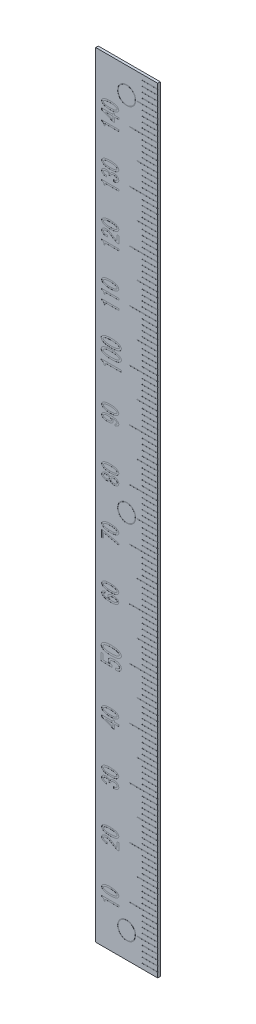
SolidWorks part; units mm, degrees
ref_plane "Front" through (0, 0, 0) normal (0, 0, 1) x (1, 0, 0)
ref_plane "Top" through (0, 0, 0) normal (0, 1, 0) x (1, 0, 0)
ref_plane "Right" through (0, 0, 0) normal (1, 0, 0) x (0, 0, -1)
sketch "Sketch1" plane through (0, 0, 0) normal (0, 0, 1) x (1, 0, 0)
  line L1 (0, 0) -> (0, 150)
  line L2 (0, 0) -> (12, 0)
  line L3 (12, 0) -> (12, 150)
  line L4 (0, 150) -> (12, 150)
  dimension "D1" = 150
  dimension "D2" = 12
extrude "Extrude1" add sketch "Sketch1" along normal blind 0.5
sketch "Sketch2" plane through (0, 0, 0.5) normal (0, 0, 1) x (1, 0, 0)
  line L0 (0, 150) -> (0, 0) construction
  line L1 (0, 0) -> (12, 0) construction
  line L2 (12, 150) -> (0, 150) construction
  circle A0 centre (6, 5) radius 1.75
  circle A1 centre (6, 145) radius 1.75
  circle A2 centre (6, 5) radius 1.65
  circle A3 centre (6, 145) radius 1.65
  circle A4 centre (6, 75) radius 1.75
  circle A5 centre (6, 75) radius 1.65
  dimension "D1" = 6
  dimension "D2" = 6
  dimension "D3" = 5
  dimension "D4" = 5
  dimension "D5" = 3.5
  dimension "D6" = 3.5
  dimension "D7" = 0.1
  dimension "D8" = 2
extrude "Extrude2" cut sketch "Sketch2" against normal blind 0.01
sketch "Sketch3" plane through (0, 0, 0.5) normal (0, 0, 1) x (1, 0, 0)
  line L0 (12, 0) -> (12, 150) construction
  line L1 (1, 137.4) -> (4.5, 137.4) construction
  line L2 (1, 137.4) -> (1, 140.9) construction
  line L3 (1, 140.9) -> (4.5, 140.9) construction
  line L4 (4.5, 137.4) -> (4.5, 140.9) construction
  line L5 (0, 150) -> (0, 0) construction
  line L6 (4.5, 127.4) -> (4.5, 130.9) construction
  line L7 (4.5, 117.4) -> (4.5, 120.9) construction
  line L8 (4.5, 107.4) -> (4.5, 110.9) construction
  line L9 (5, 97.2) -> (5, 102.8) construction
  line L10 (4.5, 88.25) -> (4.5, 91.75) construction
  line L11 (4.5, 78.25) -> (4.5, 81.75) construction
  line L12 (4.5, 68.25) -> (4.5, 71.75) construction
  line L13 (4.5, 58.25) -> (4.5, 61.75) construction
  line L14 (5, 47.375) -> (5, 52.625) construction
  line L15 (4.5, 37.375) -> (4.5, 42.625) construction
  line L16 (5, 110) -> (-4.9003, 110) construction
  line L17 (5, 50) -> (-4.9003, 50) construction
  line L18 (4.5, 27.375) -> (4.5, 32.625) construction
  line L19 (4.5, 17.375) -> (4.5, 22.625) construction
  line L20 (4.5, 7.375) -> (4.5, 12.625) construction
  line L21 (5, 100) -> (-4.9003, 100) construction
  line L22 (5, 120) -> (-4.9003, 120) construction
  line L23 (5, 130) -> (-4.9003, 130) construction
  line L24 (5, 140) -> (-4.9003, 140) construction
  text T0 "140" font "ＭＳ ゴシック" height in points 11
  text T1 "130" font "ＭＳ ゴシック" height in points 11
  text T2 "120" font "ＭＳ ゴシック" height in points 11
  text T3 "110" font "ＭＳ ゴシック" height in points 11
  text T4 "100" font "ＭＳ ゴシック" height in points 13
  text T5 "90" font "ＭＳ ゴシック" height in points 11
  text T6 "80" font "ＭＳ ゴシック" height in points 11
  text T7 "70" font "ＭＳ ゴシック" height in points 11
  text T8 "60" font "ＭＳ ゴシック" height in points 11
  text T9 "50" font "ＭＳ ゴシック" height in points 13
  text T10 "40" font "ＭＳ ゴシック" height in points 11
  text T11 "30" font "ＭＳ ゴシック" height in points 11
  text T12 "20" font "ＭＳ ゴシック" height in points 11
  text T13 "10" font "ＭＳ ゴシック" height in points 11
  point P19 (5, 100)
  dimension "D1" = 3.5
  dimension "D2" = 2.6
  dimension "D3" = 1
  dimension "D4" = 3.5
  dimension "D8" = 5.25
  dimension "D9" = 50
  dimension "D10" = 2
  dimension "D11" = 5.6
  dimension "D12" = 2.6
  dimension "D5" = 3.5
  dimension "D13" = 2.6
  dimension "D14" = 2.6
  dimension "D15" = 7
  dimension "D7" = 7
  dimension "D6" = 5
extrude "Extrude3" cut sketch "Sketch3" against normal blind 0.01
sketch "Sketch4" plane through (0, 0, 0.5) normal (0, 0, 1) x (1, 0, 0)
  line L0 (12, 140.05) -> (6.5, 140.05)
  line L1 (12, 0) -> (12, 150) construction
  line L2 (6.5, 140.05) -> (6.5, 139.95)
  line L3 (6.5, 139.95) -> (12, 139.95)
  line L4 (12, 139.95) -> (12, 140.05)
  line L5 (12, 150) -> (0, 150) construction
  line L6 (12, 148.05) -> (12, 147.95)
  line L7 (12, 144.95) -> (8, 144.95)
  line L8 (12, 144.95) -> (12, 145.05)
  line L9 (12, 145.05) -> (8, 145.05)
  line L10 (8, 144.95) -> (8, 145.05)
  line L11 (12, 149.05) -> (9, 149.05)
  line L12 (12, 149.05) -> (12, 148.95)
  line L13 (12, 148.95) -> (9, 148.95)
  line L14 (9, 149.05) -> (9, 148.95)
  line L15 (12, 148.05) -> (9, 148.05)
  line L16 (12, 147.95) -> (9, 147.95)
  line L17 (9, 148.05) -> (9, 147.95)
  line L18 (12, 147.05) -> (12, 146.95)
  line L19 (12, 147.05) -> (9, 147.05)
  line L20 (12, 146.95) -> (9, 146.95)
  line L21 (9, 147.05) -> (9, 146.95)
  line L22 (12, 146.05) -> (12, 145.95)
  line L23 (12, 146.05) -> (9, 146.05)
  line L24 (12, 145.95) -> (9, 145.95)
  line L25 (9, 146.05) -> (9, 145.95)
  line L26 (12, 130.05) -> (6.5, 130.05)
  line L27 (6.5, 130.05) -> (6.5, 129.95)
  line L28 (6.5, 129.95) -> (12, 129.95)
  line L29 (12, 129.95) -> (12, 130.05)
  line L30 (12, 144.05) -> (12, 143.95)
  line L31 (12, 144.05) -> (9, 144.05)
  line L32 (12, 143.95) -> (9, 143.95)
  line L33 (9, 144.05) -> (9, 143.95)
  line L34 (12, 143.05) -> (12, 142.95)
  line L35 (12, 143.05) -> (9, 143.05)
  line L36 (12, 142.95) -> (9, 142.95)
  line L37 (9, 143.05) -> (9, 142.95)
  line L38 (12, 142.05) -> (12, 141.95)
  line L39 (12, 142.05) -> (9, 142.05)
  line L40 (12, 141.95) -> (9, 141.95)
  line L41 (9, 142.05) -> (9, 141.95)
  line L42 (12, 141.05) -> (12, 140.95)
  line L43 (12, 141.05) -> (9, 141.05)
  line L44 (12, 140.95) -> (9, 140.95)
  line L45 (9, 141.05) -> (9, 140.95)
  line L46 (9, 145.05) -> (9, 144.95)
  line L47 (12, 145.05) -> (9, 145.05)
  line L48 (12, 144.95) -> (9, 144.95)
  line L49 (12, 145.05) -> (12, 144.95)
  line L50 (12, 138.05) -> (12, 137.95)
  line L51 (12, 134.95) -> (8, 134.95)
  line L52 (12, 134.95) -> (12, 135.05)
  line L53 (12, 135.05) -> (8, 135.05)
  line L54 (8, 134.95) -> (8, 135.05)
  line L55 (12, 139.05) -> (9, 139.05)
  line L56 (12, 139.05) -> (12, 138.95)
  line L57 (12, 138.95) -> (9, 138.95)
  line L58 (9, 139.05) -> (9, 138.95)
  line L59 (12, 138.05) -> (9, 138.05)
  line L60 (12, 137.95) -> (9, 137.95)
  line L61 (9, 138.05) -> (9, 137.95)
  line L62 (12, 137.05) -> (12, 136.95)
  line L63 (12, 137.05) -> (9, 137.05)
  line L64 (12, 136.95) -> (9, 136.95)
  line L65 (9, 137.05) -> (9, 136.95)
  line L66 (12, 136.05) -> (12, 135.95)
  line L67 (12, 136.05) -> (9, 136.05)
  line L68 (12, 135.95) -> (9, 135.95)
  line L69 (9, 136.05) -> (9, 135.95)
  line L70 (12, 134.05) -> (12, 133.95)
  line L71 (12, 134.05) -> (9, 134.05)
  line L72 (12, 133.95) -> (9, 133.95)
  line L73 (9, 134.05) -> (9, 133.95)
  line L74 (12, 133.05) -> (12, 132.95)
  line L75 (12, 133.05) -> (9, 133.05)
  line L76 (12, 132.95) -> (9, 132.95)
  line L77 (9, 133.05) -> (9, 132.95)
  line L78 (12, 132.05) -> (12, 131.95)
  line L79 (12, 132.05) -> (9, 132.05)
  line L80 (12, 131.95) -> (9, 131.95)
  line L81 (9, 132.05) -> (9, 131.95)
  line L82 (12, 131.05) -> (12, 130.95)
  line L83 (12, 131.05) -> (9, 131.05)
  line L84 (12, 130.95) -> (9, 130.95)
  line L85 (9, 131.05) -> (9, 130.95)
  line L86 (12, 120.05) -> (6.5, 120.05)
  line L87 (6.5, 120.05) -> (6.5, 119.95)
  line L88 (6.5, 119.95) -> (12, 119.95)
  line L89 (12, 119.95) -> (12, 120.05)
  line L90 (12, 128.05) -> (12, 127.95)
  line L91 (12, 124.95) -> (8, 124.95)
  line L92 (12, 124.95) -> (12, 125.05)
  line L93 (12, 125.05) -> (8, 125.05)
  line L94 (8, 124.95) -> (8, 125.05)
  line L95 (12, 129.05) -> (9, 129.05)
  line L96 (12, 129.05) -> (12, 128.95)
  line L97 (12, 128.95) -> (9, 128.95)
  line L98 (9, 129.05) -> (9, 128.95)
  line L99 (12, 128.05) -> (9, 128.05)
  line L100 (12, 127.95) -> (9, 127.95)
  line L101 (9, 128.05) -> (9, 127.95)
  line L102 (12, 127.05) -> (12, 126.95)
  line L103 (12, 127.05) -> (9, 127.05)
  line L104 (12, 126.95) -> (9, 126.95)
  line L105 (9, 127.05) -> (9, 126.95)
  line L106 (12, 126.05) -> (12, 125.95)
  line L107 (12, 126.05) -> (9, 126.05)
  line L108 (12, 125.95) -> (9, 125.95)
  line L109 (9, 126.05) -> (9, 125.95)
  line L110 (12, 124.05) -> (12, 123.95)
  line L111 (12, 124.05) -> (9, 124.05)
  line L112 (12, 123.95) -> (9, 123.95)
  line L113 (9, 124.05) -> (9, 123.95)
  line L114 (12, 123.05) -> (12, 122.95)
  line L115 (12, 123.05) -> (9, 123.05)
  line L116 (12, 122.95) -> (9, 122.95)
  line L117 (9, 123.05) -> (9, 122.95)
  line L118 (12, 122.05) -> (12, 121.95)
  line L119 (12, 122.05) -> (9, 122.05)
  line L120 (12, 121.95) -> (9, 121.95)
  line L121 (9, 122.05) -> (9, 121.95)
  line L122 (12, 121.05) -> (12, 120.95)
  line L123 (12, 121.05) -> (9, 121.05)
  line L124 (12, 120.95) -> (9, 120.95)
  line L125 (9, 121.05) -> (9, 120.95)
  line L126 (12, 110.05) -> (6.5, 110.05)
  line L127 (6.5, 110.05) -> (6.5, 109.95)
  line L128 (6.5, 109.95) -> (12, 109.95)
  line L129 (12, 109.95) -> (12, 110.05)
  line L130 (12, 118.05) -> (12, 117.95)
  line L131 (12, 114.95) -> (8, 114.95)
  line L132 (12, 114.95) -> (12, 115.05)
  line L133 (12, 115.05) -> (8, 115.05)
  line L134 (8, 114.95) -> (8, 115.05)
  line L135 (12, 119.05) -> (9, 119.05)
  line L136 (12, 119.05) -> (12, 118.95)
  line L137 (12, 118.95) -> (9, 118.95)
  line L138 (9, 119.05) -> (9, 118.95)
  line L139 (12, 118.05) -> (9, 118.05)
  line L140 (12, 117.95) -> (9, 117.95)
  line L141 (9, 118.05) -> (9, 117.95)
  line L142 (12, 117.05) -> (12, 116.95)
  line L143 (12, 117.05) -> (9, 117.05)
  line L144 (12, 116.95) -> (9, 116.95)
  line L145 (9, 117.05) -> (9, 116.95)
  line L146 (12, 116.05) -> (12, 115.95)
  line L147 (12, 116.05) -> (9, 116.05)
  line L148 (12, 115.95) -> (9, 115.95)
  line L149 (9, 116.05) -> (9, 115.95)
  line L150 (12, 114.05) -> (12, 113.95)
  line L151 (12, 114.05) -> (9, 114.05)
  line L152 (12, 113.95) -> (9, 113.95)
  line L153 (9, 114.05) -> (9, 113.95)
  line L154 (12, 113.05) -> (12, 112.95)
  line L155 (12, 113.05) -> (9, 113.05)
  line L156 (12, 112.95) -> (9, 112.95)
  line L157 (9, 113.05) -> (9, 112.95)
  line L158 (12, 112.05) -> (12, 111.95)
  line L159 (12, 112.05) -> (9, 112.05)
  line L160 (12, 111.95) -> (9, 111.95)
  line L161 (9, 112.05) -> (9, 111.95)
  line L162 (12, 111.05) -> (12, 110.95)
  line L163 (12, 111.05) -> (9, 111.05)
  line L164 (12, 110.95) -> (9, 110.95)
  line L165 (9, 111.05) -> (9, 110.95)
  line L166 (12, 100.05) -> (6.5, 100.05)
  line L167 (6.5, 100.05) -> (6.5, 99.95)
  line L168 (6.5, 99.95) -> (12, 99.95)
  line L169 (12, 99.95) -> (12, 100.05)
  line L170 (12, 108.05) -> (12, 107.95)
  line L171 (12, 104.95) -> (8, 104.95)
  line L172 (12, 104.95) -> (12, 105.05)
  line L173 (12, 105.05) -> (8, 105.05)
  line L174 (8, 104.95) -> (8, 105.05)
  line L175 (12, 109.05) -> (9, 109.05)
  line L176 (12, 109.05) -> (12, 108.95)
  line L177 (12, 108.95) -> (9, 108.95)
  line L178 (9, 109.05) -> (9, 108.95)
  line L179 (12, 108.05) -> (9, 108.05)
  line L180 (12, 107.95) -> (9, 107.95)
  line L181 (9, 108.05) -> (9, 107.95)
  line L182 (12, 107.05) -> (12, 106.95)
  line L183 (12, 107.05) -> (9, 107.05)
  line L184 (12, 106.95) -> (9, 106.95)
  line L185 (9, 107.05) -> (9, 106.95)
  line L186 (12, 106.05) -> (12, 105.95)
  line L187 (12, 106.05) -> (9, 106.05)
  line L188 (12, 105.95) -> (9, 105.95)
  line L189 (9, 106.05) -> (9, 105.95)
  line L190 (12, 104.05) -> (12, 103.95)
  line L191 (12, 104.05) -> (9, 104.05)
  line L192 (12, 103.95) -> (9, 103.95)
  line L193 (9, 104.05) -> (9, 103.95)
  line L194 (12, 103.05) -> (12, 102.95)
  line L195 (12, 103.05) -> (9, 103.05)
  line L196 (12, 102.95) -> (9, 102.95)
  line L197 (9, 103.05) -> (9, 102.95)
  line L198 (12, 102.05) -> (12, 101.95)
  line L199 (12, 102.05) -> (9, 102.05)
  line L200 (12, 101.95) -> (9, 101.95)
  line L201 (9, 102.05) -> (9, 101.95)
  line L202 (12, 101.05) -> (12, 100.95)
  line L203 (12, 101.05) -> (9, 101.05)
  line L204 (12, 100.95) -> (9, 100.95)
  line L205 (9, 101.05) -> (9, 100.95)
  line L206 (12, 100.05) -> (6.5, 100.05)
  line L207 (6.5, 100.05) -> (6.5, 99.95)
  line L208 (6.5, 99.95) -> (12, 99.95)
  line L209 (12, 99.95) -> (12, 100.05)
  line L210 (12, 98.05) -> (12, 97.95)
  line L211 (12, 94.95) -> (8, 94.95)
  line L212 (12, 94.95) -> (12, 95.05)
  line L213 (12, 95.05) -> (8, 95.05)
  line L214 (8, 94.95) -> (8, 95.05)
  line L215 (12, 99.05) -> (9, 99.05)
  line L216 (12, 99.05) -> (12, 98.95)
  line L217 (12, 98.95) -> (9, 98.95)
  line L218 (9, 99.05) -> (9, 98.95)
  line L219 (12, 98.05) -> (9, 98.05)
  line L220 (12, 97.95) -> (9, 97.95)
  line L221 (9, 98.05) -> (9, 97.95)
  line L222 (12, 97.05) -> (12, 96.95)
  line L223 (12, 97.05) -> (9, 97.05)
  line L224 (12, 96.95) -> (9, 96.95)
  line L225 (9, 97.05) -> (9, 96.95)
  line L226 (12, 96.05) -> (12, 95.95)
  line L227 (12, 96.05) -> (9, 96.05)
  line L228 (12, 95.95) -> (9, 95.95)
  line L229 (9, 96.05) -> (9, 95.95)
  line L230 (12, 94.05) -> (12, 93.95)
  line L231 (12, 94.05) -> (9, 94.05)
  line L232 (12, 93.95) -> (9, 93.95)
  line L233 (9, 94.05) -> (9, 93.95)
  line L234 (12, 93.05) -> (12, 92.95)
  line L235 (12, 93.05) -> (9, 93.05)
  line L236 (12, 92.95) -> (9, 92.95)
  line L237 (9, 93.05) -> (9, 92.95)
  line L238 (12, 92.05) -> (12, 91.95)
  line L239 (12, 92.05) -> (9, 92.05)
  line L240 (12, 91.95) -> (9, 91.95)
  line L241 (9, 92.05) -> (9, 91.95)
  line L242 (12, 91.05) -> (12, 90.95)
  line L243 (12, 91.05) -> (9, 91.05)
  line L244 (12, 90.95) -> (9, 90.95)
  line L245 (9, 91.05) -> (9, 90.95)
  line L246 (12, 90.05) -> (6.5, 90.05)
  line L247 (6.5, 90.05) -> (6.5, 89.95)
  line L248 (6.5, 89.95) -> (12, 89.95)
  line L249 (12, 89.95) -> (12, 90.05)
  line L250 (12, 88.05) -> (12, 87.95)
  line L251 (12, 84.95) -> (8, 84.95)
  line L252 (12, 84.95) -> (12, 85.05)
  line L253 (12, 85.05) -> (8, 85.05)
  line L254 (8, 84.95) -> (8, 85.05)
  line L255 (12, 89.05) -> (9, 89.05)
  line L256 (12, 89.05) -> (12, 88.95)
  line L257 (12, 88.95) -> (9, 88.95)
  line L258 (9, 89.05) -> (9, 88.95)
  line L259 (12, 88.05) -> (9, 88.05)
  line L260 (12, 87.95) -> (9, 87.95)
  line L261 (9, 88.05) -> (9, 87.95)
  line L262 (12, 87.05) -> (12, 86.95)
  line L263 (12, 87.05) -> (9, 87.05)
  line L264 (12, 86.95) -> (9, 86.95)
  line L265 (9, 87.05) -> (9, 86.95)
  line L266 (12, 86.05) -> (12, 85.95)
  line L267 (12, 86.05) -> (9, 86.05)
  line L268 (12, 85.95) -> (9, 85.95)
  line L269 (9, 86.05) -> (9, 85.95)
  line L270 (12, 84.05) -> (12, 83.95)
  line L271 (12, 84.05) -> (9, 84.05)
  line L272 (12, 83.95) -> (9, 83.95)
  line L273 (9, 84.05) -> (9, 83.95)
  line L274 (12, 83.05) -> (12, 82.95)
  line L275 (12, 83.05) -> (9, 83.05)
  line L276 (12, 82.95) -> (9, 82.95)
  line L277 (9, 83.05) -> (9, 82.95)
  line L278 (12, 82.05) -> (12, 81.95)
  line L279 (12, 82.05) -> (9, 82.05)
  line L280 (12, 81.95) -> (9, 81.95)
  line L281 (9, 82.05) -> (9, 81.95)
  line L282 (12, 81.05) -> (12, 80.95)
  line L283 (12, 81.05) -> (9, 81.05)
  line L284 (12, 80.95) -> (9, 80.95)
  line L285 (9, 81.05) -> (9, 80.95)
  line L286 (12, 80.05) -> (6.5, 80.05)
  line L287 (6.5, 80.05) -> (6.5, 79.95)
  line L288 (6.5, 79.95) -> (12, 79.95)
  line L289 (12, 79.95) -> (12, 80.05)
  line L290 (12, 78.05) -> (12, 77.95)
  line L291 (12, 74.95) -> (8, 74.95)
  line L292 (12, 74.95) -> (12, 75.05)
  line L293 (12, 75.05) -> (8, 75.05)
  line L294 (8, 74.95) -> (8, 75.05)
  line L295 (12, 79.05) -> (9, 79.05)
  line L296 (12, 79.05) -> (12, 78.95)
  line L297 (12, 78.95) -> (9, 78.95)
  line L298 (9, 79.05) -> (9, 78.95)
  line L299 (12, 78.05) -> (9, 78.05)
  line L300 (12, 77.95) -> (9, 77.95)
  line L301 (9, 78.05) -> (9, 77.95)
  line L302 (12, 77.05) -> (12, 76.95)
  line L303 (12, 77.05) -> (9, 77.05)
  line L304 (12, 76.95) -> (9, 76.95)
  line L305 (9, 77.05) -> (9, 76.95)
  line L306 (12, 76.05) -> (12, 75.95)
  line L307 (12, 76.05) -> (9, 76.05)
  line L308 (12, 75.95) -> (9, 75.95)
  line L309 (9, 76.05) -> (9, 75.95)
  line L310 (12, 74.05) -> (12, 73.95)
  line L311 (12, 74.05) -> (9, 74.05)
  line L312 (12, 73.95) -> (9, 73.95)
  line L313 (9, 74.05) -> (9, 73.95)
  line L314 (12, 73.05) -> (12, 72.95)
  line L315 (12, 73.05) -> (9, 73.05)
  line L316 (12, 72.95) -> (9, 72.95)
  line L317 (9, 73.05) -> (9, 72.95)
  line L318 (12, 72.05) -> (12, 71.95)
  line L319 (12, 72.05) -> (9, 72.05)
  line L320 (12, 71.95) -> (9, 71.95)
  line L321 (9, 72.05) -> (9, 71.95)
  line L322 (12, 71.05) -> (12, 70.95)
  line L323 (12, 71.05) -> (9, 71.05)
  line L324 (12, 70.95) -> (9, 70.95)
  line L325 (9, 71.05) -> (9, 70.95)
  line L326 (12, 70.05) -> (6.5, 70.05)
  line L327 (6.5, 70.05) -> (6.5, 69.95)
  line L328 (6.5, 69.95) -> (12, 69.95)
  line L329 (12, 69.95) -> (12, 70.05)
  line L330 (12, 68.05) -> (12, 67.95)
  line L331 (12, 64.95) -> (8, 64.95)
  line L332 (12, 64.95) -> (12, 65.05)
  line L333 (12, 65.05) -> (8, 65.05)
  line L334 (8, 64.95) -> (8, 65.05)
  line L335 (12, 69.05) -> (9, 69.05)
  line L336 (12, 69.05) -> (12, 68.95)
  line L337 (12, 68.95) -> (9, 68.95)
  line L338 (9, 69.05) -> (9, 68.95)
  line L339 (12, 68.05) -> (9, 68.05)
  line L340 (12, 67.95) -> (9, 67.95)
  line L341 (9, 68.05) -> (9, 67.95)
  line L342 (12, 67.05) -> (12, 66.95)
  line L343 (12, 67.05) -> (9, 67.05)
  line L344 (12, 66.95) -> (9, 66.95)
  line L345 (9, 67.05) -> (9, 66.95)
  line L346 (12, 66.05) -> (12, 65.95)
  line L347 (12, 66.05) -> (9, 66.05)
  line L348 (12, 65.95) -> (9, 65.95)
  line L349 (9, 66.05) -> (9, 65.95)
  line L350 (12, 64.05) -> (12, 63.95)
  line L351 (12, 64.05) -> (9, 64.05)
  line L352 (12, 63.95) -> (9, 63.95)
  line L353 (9, 64.05) -> (9, 63.95)
  line L354 (12, 63.05) -> (12, 62.95)
  line L355 (12, 63.05) -> (9, 63.05)
  line L356 (12, 62.95) -> (9, 62.95)
  line L357 (9, 63.05) -> (9, 62.95)
  line L358 (12, 62.05) -> (12, 61.95)
  line L359 (12, 62.05) -> (9, 62.05)
  line L360 (12, 61.95) -> (9, 61.95)
  line L361 (9, 62.05) -> (9, 61.95)
  line L362 (12, 61.05) -> (12, 60.95)
  line L363 (12, 61.05) -> (9, 61.05)
  line L364 (12, 60.95) -> (9, 60.95)
  line L365 (9, 61.05) -> (9, 60.95)
  line L366 (12, 60.05) -> (6.5, 60.05)
  line L367 (6.5, 60.05) -> (6.5, 59.95)
  line L368 (6.5, 59.95) -> (12, 59.95)
  line L369 (12, 59.95) -> (12, 60.05)
  line L370 (12, 58.05) -> (12, 57.95)
  line L371 (12, 54.95) -> (8, 54.95)
  line L372 (12, 54.95) -> (12, 55.05)
  line L373 (12, 55.05) -> (8, 55.05)
  line L374 (8, 54.95) -> (8, 55.05)
  line L375 (12, 59.05) -> (9, 59.05)
  line L376 (12, 59.05) -> (12, 58.95)
  line L377 (12, 58.95) -> (9, 58.95)
  line L378 (9, 59.05) -> (9, 58.95)
  line L379 (12, 58.05) -> (9, 58.05)
  line L380 (12, 57.95) -> (9, 57.95)
  line L381 (9, 58.05) -> (9, 57.95)
  line L382 (12, 57.05) -> (12, 56.95)
  line L383 (12, 57.05) -> (9, 57.05)
  line L384 (12, 56.95) -> (9, 56.95)
  line L385 (9, 57.05) -> (9, 56.95)
  line L386 (12, 56.05) -> (12, 55.95)
  line L387 (12, 56.05) -> (9, 56.05)
  line L388 (12, 55.95) -> (9, 55.95)
  line L389 (9, 56.05) -> (9, 55.95)
  line L390 (12, 54.05) -> (12, 53.95)
  line L391 (12, 54.05) -> (9, 54.05)
  line L392 (12, 53.95) -> (9, 53.95)
  line L393 (9, 54.05) -> (9, 53.95)
  line L394 (12, 53.05) -> (12, 52.95)
  line L395 (12, 53.05) -> (9, 53.05)
  line L396 (12, 52.95) -> (9, 52.95)
  line L397 (9, 53.05) -> (9, 52.95)
  line L398 (12, 52.05) -> (12, 51.95)
  line L399 (12, 52.05) -> (9, 52.05)
  line L400 (12, 51.95) -> (9, 51.95)
  line L401 (9, 52.05) -> (9, 51.95)
  line L402 (12, 51.05) -> (12, 50.95)
  line L403 (12, 51.05) -> (9, 51.05)
  line L404 (12, 50.95) -> (9, 50.95)
  line L405 (9, 51.05) -> (9, 50.95)
  line L406 (12, 50.05) -> (6.5, 50.05)
  line L407 (6.5, 50.05) -> (6.5, 49.95)
  line L408 (6.5, 49.95) -> (12, 49.95)
  line L409 (12, 49.95) -> (12, 50.05)
  line L410 (12, 48.05) -> (12, 47.95)
  line L411 (12, 44.95) -> (8, 44.95)
  line L412 (12, 44.95) -> (12, 45.05)
  line L413 (12, 45.05) -> (8, 45.05)
  line L414 (8, 44.95) -> (8, 45.05)
  line L415 (12, 49.05) -> (9, 49.05)
  line L416 (12, 49.05) -> (12, 48.95)
  line L417 (12, 48.95) -> (9, 48.95)
  line L418 (9, 49.05) -> (9, 48.95)
  line L419 (12, 48.05) -> (9, 48.05)
  line L420 (12, 47.95) -> (9, 47.95)
  line L421 (9, 48.05) -> (9, 47.95)
  line L422 (12, 47.05) -> (12, 46.95)
  line L423 (12, 47.05) -> (9, 47.05)
  line L424 (12, 46.95) -> (9, 46.95)
  line L425 (9, 47.05) -> (9, 46.95)
  line L426 (12, 46.05) -> (12, 45.95)
  line L427 (12, 46.05) -> (9, 46.05)
  line L428 (12, 45.95) -> (9, 45.95)
  line L429 (9, 46.05) -> (9, 45.95)
  line L430 (12, 44.05) -> (12, 43.95)
  line L431 (12, 44.05) -> (9, 44.05)
  line L432 (12, 43.95) -> (9, 43.95)
  line L433 (9, 44.05) -> (9, 43.95)
  line L434 (12, 43.05) -> (12, 42.95)
  line L435 (12, 43.05) -> (9, 43.05)
  line L436 (12, 42.95) -> (9, 42.95)
  line L437 (9, 43.05) -> (9, 42.95)
  line L438 (12, 42.05) -> (12, 41.95)
  line L439 (12, 42.05) -> (9, 42.05)
  line L440 (12, 41.95) -> (9, 41.95)
  line L441 (9, 42.05) -> (9, 41.95)
  line L442 (12, 41.05) -> (12, 40.95)
  line L443 (12, 41.05) -> (9, 41.05)
  line L444 (12, 40.95) -> (9, 40.95)
  line L445 (9, 41.05) -> (9, 40.95)
  line L446 (12, 40.05) -> (6.5, 40.05)
  line L447 (6.5, 40.05) -> (6.5, 39.95)
  line L448 (6.5, 39.95) -> (12, 39.95)
  line L449 (12, 39.95) -> (12, 40.05)
  line L450 (12, 38.05) -> (12, 37.95)
  line L451 (12, 34.95) -> (8, 34.95)
  line L452 (12, 34.95) -> (12, 35.05)
  line L453 (12, 35.05) -> (8, 35.05)
  line L454 (8, 34.95) -> (8, 35.05)
  line L455 (12, 39.05) -> (9, 39.05)
  line L456 (12, 39.05) -> (12, 38.95)
  line L457 (12, 38.95) -> (9, 38.95)
  line L458 (9, 39.05) -> (9, 38.95)
  line L459 (12, 38.05) -> (9, 38.05)
  line L460 (12, 37.95) -> (9, 37.95)
  line L461 (9, 38.05) -> (9, 37.95)
  line L462 (12, 37.05) -> (12, 36.95)
  line L463 (12, 37.05) -> (9, 37.05)
  line L464 (12, 36.95) -> (9, 36.95)
  line L465 (9, 37.05) -> (9, 36.95)
  line L466 (12, 36.05) -> (12, 35.95)
  line L467 (12, 36.05) -> (9, 36.05)
  line L468 (12, 35.95) -> (9, 35.95)
  line L469 (9, 36.05) -> (9, 35.95)
  line L470 (12, 34.05) -> (12, 33.95)
  line L471 (12, 34.05) -> (9, 34.05)
  line L472 (12, 33.95) -> (9, 33.95)
  line L473 (9, 34.05) -> (9, 33.95)
  line L474 (12, 33.05) -> (12, 32.95)
  line L475 (12, 33.05) -> (9, 33.05)
  line L476 (12, 32.95) -> (9, 32.95)
  line L477 (9, 33.05) -> (9, 32.95)
  line L478 (12, 32.05) -> (12, 31.95)
  line L479 (12, 32.05) -> (9, 32.05)
  line L480 (12, 31.95) -> (9, 31.95)
  line L481 (9, 32.05) -> (9, 31.95)
  line L482 (12, 31.05) -> (12, 30.95)
  line L483 (12, 31.05) -> (9, 31.05)
  line L484 (12, 30.95) -> (9, 30.95)
  line L485 (9, 31.05) -> (9, 30.95)
  line L486 (12, 30.05) -> (6.5, 30.05)
  line L487 (6.5, 30.05) -> (6.5, 29.95)
  line L488 (6.5, 29.95) -> (12, 29.95)
  line L489 (12, 29.95) -> (12, 30.05)
  line L490 (12, 28.05) -> (12, 27.95)
  line L491 (12, 24.95) -> (8, 24.95)
  line L492 (12, 24.95) -> (12, 25.05)
  line L493 (12, 25.05) -> (8, 25.05)
  line L494 (8, 24.95) -> (8, 25.05)
  line L495 (12, 29.05) -> (9, 29.05)
  line L496 (12, 29.05) -> (12, 28.95)
  line L497 (12, 28.95) -> (9, 28.95)
  line L498 (9, 29.05) -> (9, 28.95)
  line L499 (12, 28.05) -> (9, 28.05)
  line L500 (12, 27.95) -> (9, 27.95)
  line L501 (9, 28.05) -> (9, 27.95)
  line L502 (12, 27.05) -> (12, 26.95)
  line L503 (12, 27.05) -> (9, 27.05)
  line L504 (12, 26.95) -> (9, 26.95)
  line L505 (9, 27.05) -> (9, 26.95)
  line L506 (12, 26.05) -> (12, 25.95)
  line L507 (12, 26.05) -> (9, 26.05)
  line L508 (12, 25.95) -> (9, 25.95)
  line L509 (9, 26.05) -> (9, 25.95)
  line L510 (12, 24.05) -> (12, 23.95)
  line L511 (12, 24.05) -> (9, 24.05)
  line L512 (12, 23.95) -> (9, 23.95)
  line L513 (9, 24.05) -> (9, 23.95)
  line L514 (12, 23.05) -> (12, 22.95)
  line L515 (12, 23.05) -> (9, 23.05)
  line L516 (12, 22.95) -> (9, 22.95)
  line L517 (9, 23.05) -> (9, 22.95)
  line L518 (12, 22.05) -> (12, 21.95)
  line L519 (12, 22.05) -> (9, 22.05)
  line L520 (12, 21.95) -> (9, 21.95)
  line L521 (9, 22.05) -> (9, 21.95)
  line L522 (12, 21.05) -> (12, 20.95)
  line L523 (12, 21.05) -> (9, 21.05)
  line L524 (12, 20.95) -> (9, 20.95)
  line L525 (9, 21.05) -> (9, 20.95)
  line L526 (12, 20.05) -> (6.5, 20.05)
  line L527 (6.5, 20.05) -> (6.5, 19.95)
  line L528 (6.5, 19.95) -> (12, 19.95)
  line L529 (12, 19.95) -> (12, 20.05)
  line L530 (12, 18.05) -> (12, 17.95)
  line L531 (12, 14.95) -> (8, 14.95)
  line L532 (12, 14.95) -> (12, 15.05)
  line L533 (12, 15.05) -> (8, 15.05)
  line L534 (8, 14.95) -> (8, 15.05)
  line L535 (12, 19.05) -> (9, 19.05)
  line L536 (12, 19.05) -> (12, 18.95)
  line L537 (12, 18.95) -> (9, 18.95)
  line L538 (9, 19.05) -> (9, 18.95)
  line L539 (12, 18.05) -> (9, 18.05)
  line L540 (12, 17.95) -> (9, 17.95)
  line L541 (9, 18.05) -> (9, 17.95)
  line L542 (12, 17.05) -> (12, 16.95)
  line L543 (12, 17.05) -> (9, 17.05)
  line L544 (12, 16.95) -> (9, 16.95)
  line L545 (9, 17.05) -> (9, 16.95)
  line L546 (12, 16.05) -> (12, 15.95)
  line L547 (12, 16.05) -> (9, 16.05)
  line L548 (12, 15.95) -> (9, 15.95)
  line L549 (9, 16.05) -> (9, 15.95)
  line L550 (12, 14.05) -> (12, 13.95)
  line L551 (12, 14.05) -> (9, 14.05)
  line L552 (12, 13.95) -> (9, 13.95)
  line L553 (9, 14.05) -> (9, 13.95)
  line L554 (12, 13.05) -> (12, 12.95)
  line L555 (12, 13.05) -> (9, 13.05)
  line L556 (12, 12.95) -> (9, 12.95)
  line L557 (9, 13.05) -> (9, 12.95)
  line L558 (12, 12.05) -> (12, 11.95)
  line L559 (12, 12.05) -> (9, 12.05)
  line L560 (12, 11.95) -> (9, 11.95)
  line L561 (9, 12.05) -> (9, 11.95)
  line L562 (12, 11.05) -> (12, 10.95)
  line L563 (12, 11.05) -> (9, 11.05)
  line L564 (12, 10.95) -> (9, 10.95)
  line L565 (9, 11.05) -> (9, 10.95)
  line L566 (12, 10.05) -> (6.5, 10.05)
  line L567 (6.5, 10.05) -> (6.5, 9.95)
  line L568 (6.5, 9.95) -> (12, 9.95)
  line L569 (12, 9.95) -> (12, 10.05)
  line L570 (12, 8.05) -> (12, 7.95)
  line L571 (12, 4.95) -> (8, 4.95)
  line L572 (12, 4.95) -> (12, 5.05)
  line L573 (12, 5.05) -> (8, 5.05)
  line L574 (8, 4.95) -> (8, 5.05)
  line L575 (12, 9.05) -> (9, 9.05)
  line L576 (12, 9.05) -> (12, 8.95)
  line L577 (12, 8.95) -> (9, 8.95)
  line L578 (9, 9.05) -> (9, 8.95)
  line L579 (12, 8.05) -> (9, 8.05)
  line L580 (12, 7.95) -> (9, 7.95)
  line L581 (9, 8.05) -> (9, 7.95)
  line L582 (12, 7.05) -> (12, 6.95)
  line L583 (12, 7.05) -> (9, 7.05)
  line L584 (12, 6.95) -> (9, 6.95)
  line L585 (9, 7.05) -> (9, 6.95)
  line L586 (12, 6.05) -> (12, 5.95)
  line L587 (12, 6.05) -> (9, 6.05)
  line L588 (12, 5.95) -> (9, 5.95)
  line L589 (9, 6.05) -> (9, 5.95)
  line L590 (12, 4.05) -> (12, 3.95)
  line L591 (12, 4.05) -> (9, 4.05)
  line L592 (12, 3.95) -> (9, 3.95)
  line L593 (9, 4.05) -> (9, 3.95)
  line L594 (12, 3.05) -> (12, 2.95)
  line L595 (12, 3.05) -> (9, 3.05)
  line L596 (12, 2.95) -> (9, 2.95)
  line L597 (9, 3.05) -> (9, 2.95)
  line L598 (12, 2.05) -> (12, 1.95)
  line L599 (12, 2.05) -> (9, 2.05)
  line L600 (12, 1.95) -> (9, 1.95)
  line L601 (9, 2.05) -> (9, 1.95)
  line L602 (12, 1.05) -> (12, 0.95)
  line L603 (12, 1.05) -> (9, 1.05)
  line L604 (12, 0.95) -> (9, 0.95)
  line L605 (9, 1.05) -> (9, 0.95)
  point P4 (12, 140)
  point P13 (12, 145)
  point P18 (12, 149)
  dimension "D1" = 10
  dimension "D2" = 0.1
  dimension "D3" = 5.5
  dimension "D4" = 5
  dimension "D5" = 0.1
  dimension "D6" = 1
  dimension "D7" = 0.1
  dimension "D8" = 3
  dimension "D9" = 4
  dimension "D10" = 9
  dimension "D11" = 5
  dimension "D12" = 6
  dimension "D13" = 6
extrude "Extrude4" cut sketch "Sketch4" against normal blind 0.01
move or copy body "Body-Move/Copy2" bodies to move or copy 105 copy no translate (-12, 0, 0)
